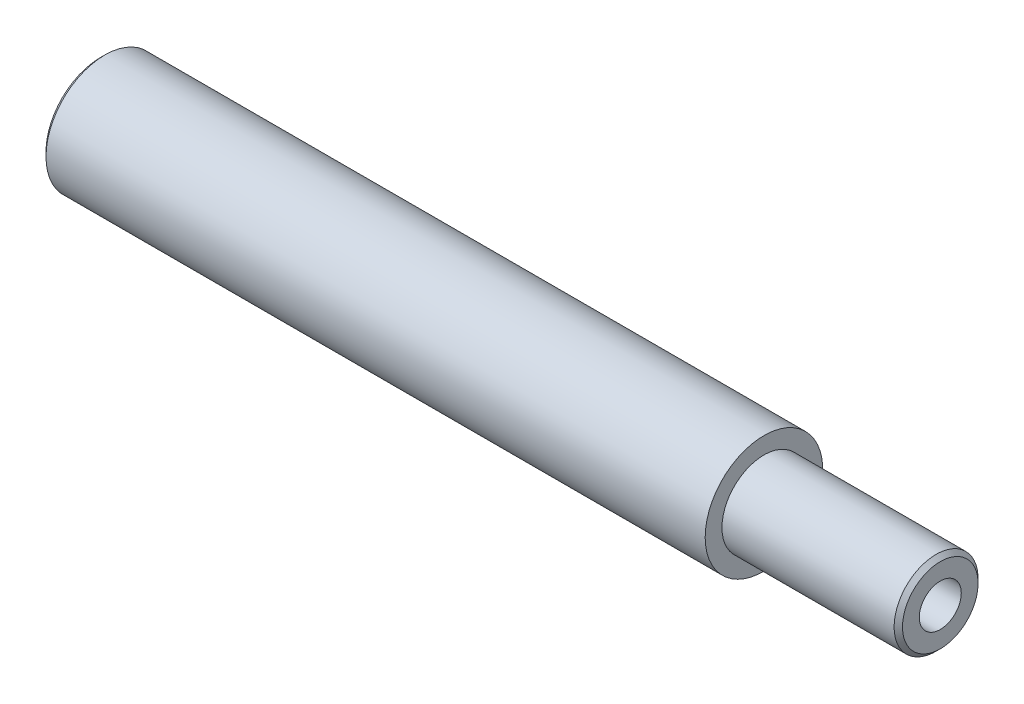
SolidWorks part; units mm, degrees
ref_plane "Plan de face" through (0, 0, 0) normal (0, 0, 1) x (1, 0, 0)
ref_plane "Plan de dessus" through (0, 0, 0) normal (0, 1, 0) x (1, 0, 0)
ref_plane "Plan de droite" through (0, 0, 0) normal (1, 0, 0) x (0, 0, -1)
sketch "Esquisse1" plane through (0, 0, 0) normal (0, 0, 1) x (1, 0, 0)
  line L0 (0, 0) -> (0, 7)
  line L1 (0, 7) -> (79, 7)
  line L2 (79, 7) -> (79, 5)
  line L3 (79, 5) -> (100, 5)
  line L4 (100, 5) -> (100, 0)
  line L5 (0, 0) -> (100, 0) construction
  line L6 (0, 0) -> (100, 0)
  dimension "D1" = 10
  dimension "D2" = 14
  dimension "D3" = 21
  dimension "D4" = 100
revolve "Révolution1" add sketch "Esquisse1" angle 360 about L5
hole_wizard "Trou taraudé M61" positions "Esquisse3" profile "Esquisse2" tap size "M6" standard "ISO"
sketch "Esquisse3" plane through (100, 0, 0) normal (1, 0, 0) x (0, 0, -1)
  point P0 (0, 0)
sketch "Esquisse2" plane through (100, 0, 0) normal (0, 1, 0) x (0, 0, -1)
  line L0 (0, 0) -> (0, 21.5022)
  line L1 (0, 21.5022) -> (2.5, 20)
  line L2 (2.5, 20) -> (2.5, 0)
  line L5 (2.5, 0) -> (0, 0)
  line L10 (0, 21.5022) -> (-2.5, 20) construction
  line L11 (0, -6.35) -> (0, 107.95) construction
  dimension "Diamètre du trou pour taraudage" = 5
  dimension "Profondeur du trou pour taraudage" = 20
  dimension "Angle de pointe" = 118
chamfer "Chanfrein1" distance 0.5 angle 45 2 edges at (100, 0, 5) (0, 0, 7)
hole_wizard "Trou taraudé M63" positions "Esquisse7" profile "Esquisse6" tap size "M6" standard "ISO"
sketch "Esquisse7" plane through (0, 0, 0) normal (-1, 0, 0) x (0, 0, 1)
  point P0 (0, 0)
sketch "Esquisse6" plane through (0, 0, 0) normal (0, 1, 0) x (0, 0, 1)
  line L0 (0, 0) -> (0, 21.5022)
  line L1 (0, 21.5022) -> (2.5, 20)
  line L2 (2.5, 20) -> (2.5, 0)
  line L5 (2.5, 0) -> (0, 0)
  line L10 (0, 21.5022) -> (-2.5, 20) construction
  line L11 (0, -6.35) -> (0, 107.95) construction
  dimension "Diamètre du trou pour taraudage" = 5
  dimension "Profondeur du trou pour taraudage" = 20
  dimension "Angle de pointe" = 118
